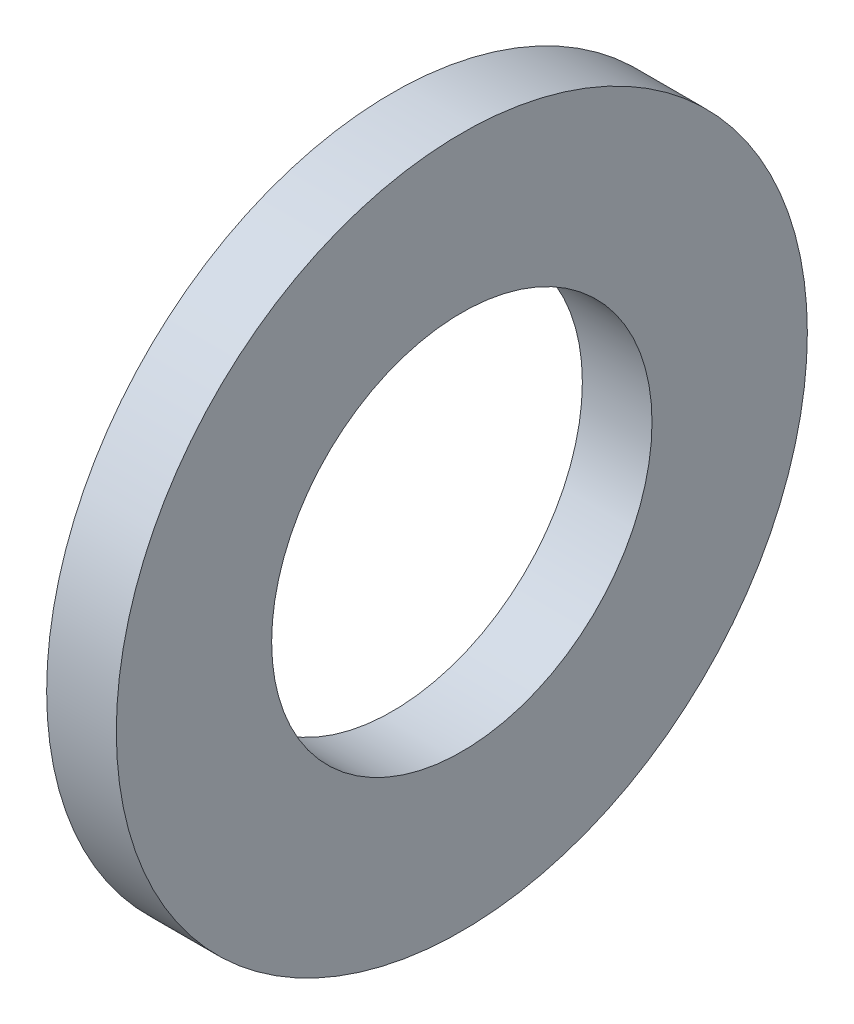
SolidWorks part; units mm, degrees
ref_plane "Plane1" through (0, 0, 0) normal (0, 0, 1) x (1, 0, 0)
ref_plane "Plane2" through (0, 0, 0) normal (0, 1, 0) x (1, 0, 0)
ref_plane "Plane3" through (0, 0, 0) normal (1, 0, 0) x (0, 0, -1)
revolve "Base-Revolve" add sketch "Sketch1" angle 360 about L0
sketch "Sketch1" plane through (0, 0, 0) normal (0, 0, 1) x (1, 0, 0)
  line L0 (-34.925, 0) -> (9.525, 0) construction
  line L1 (0, 4.3688) -> (0, 7.9375)
  line L2 (0, 7.9375) -> (-1.6002, 7.9375)
  line L3 (-1.6002, 7.9375) -> (-1.6002, 4.3688)
  line L4 (-1.6002, 4.3688) -> (0, 4.3688)
  dimension "Thickness" = 1.6002
  dimension "Inside_dia" = 8.7376
  dimension "Outside_dia" = 15.875
